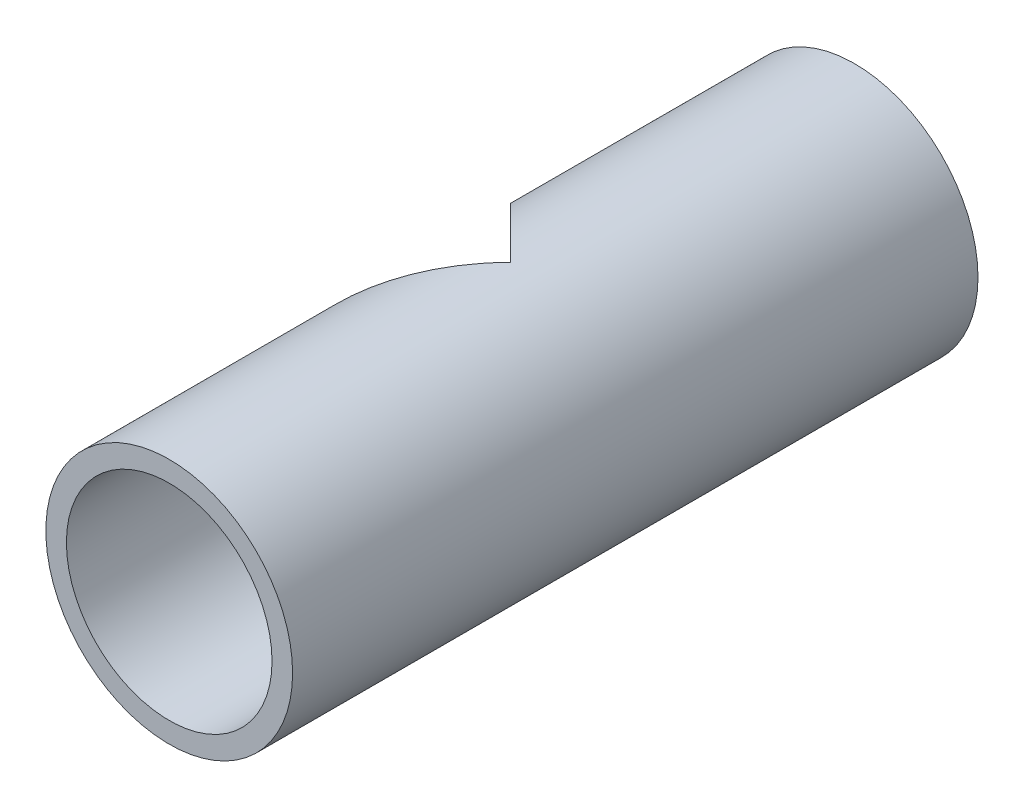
SolidWorks part; units mm, degrees
ref_plane "Front Plane" through (0, 0, 0) normal (0, 0, 1) x (1, 0, 0)
ref_plane "Top Plane" through (0, 0, 0) normal (0, 1, 0) x (1, 0, 0)
ref_plane "Right Plane" through (0, 0, 0) normal (1, 0, 0) x (0, 0, -1)
sketch "Sketch1" plane through (0, 0, 0) normal (0, 0, 1) x (1, 0, 0)
  circle A0 centre (0, 0) radius 15
  circle A1 centre (0, 0) radius 18
extrude "Boss-Extrude1" add sketch "Sketch1" along normal blind 100
ref_plane "Plane1" through (0, 0, 0) normal (1, 0, 0) x (0, 0, -1)
sketch "Sketch2" plane through (0, 0, 0) normal (1, 0, 0) x (0, 0, -1)
  circle A0 centre (-50.2241, 0) radius 18
extrude "Cut-Extrude1" cut sketch "Sketch2" against normal blind 30
